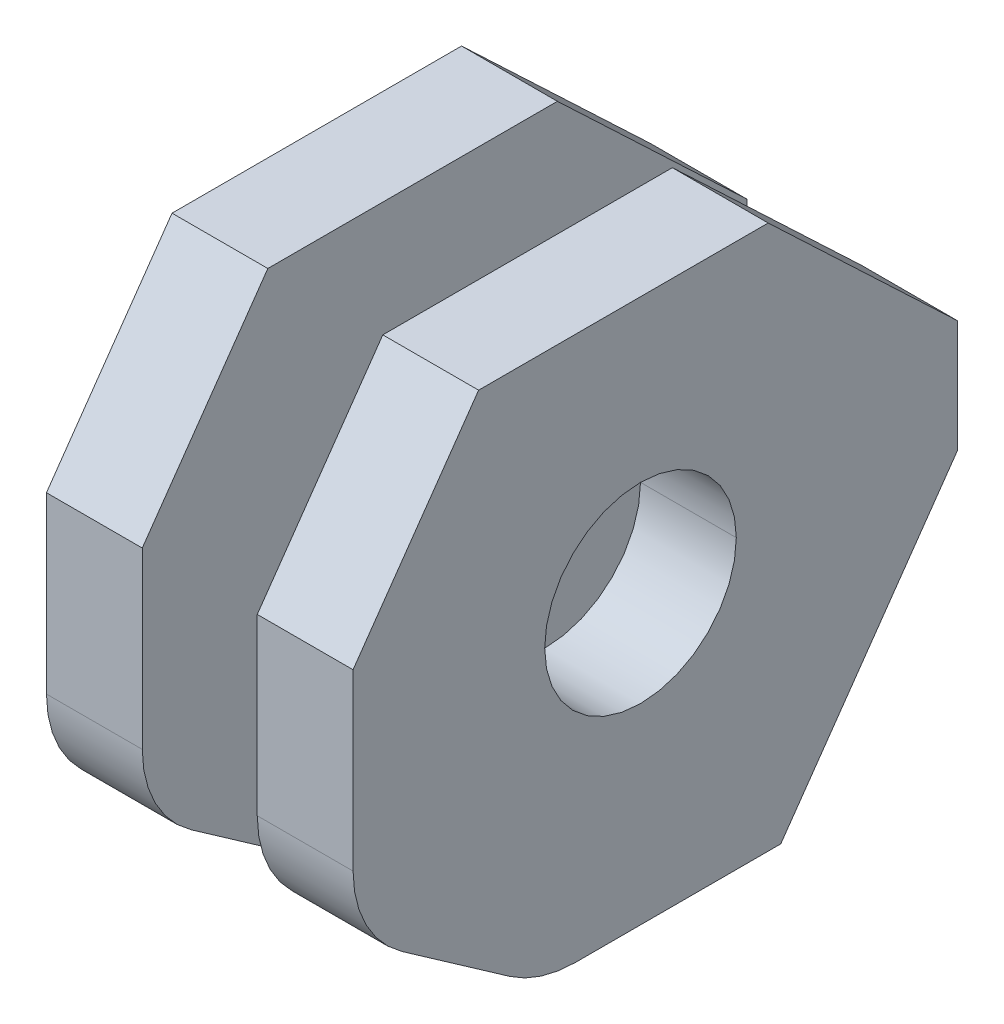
SolidWorks part; units mm, degrees
ref_plane "前视基准面" through (0, 0, 0) normal (0, 0, 1) x (1, 0, 0)
ref_plane "上视基准面" through (0, 0, 0) normal (0, 1, 0) x (1, 0, 0)
ref_plane "右视基准面" through (0, 0, 0) normal (1, 0, 0) x (0, 0, -1)
other "Configuration Table"
imported_body "D435_Mount_V3.STEP<1>"
sketch "草图2" plane through (4.3614, 0, 0) normal (1, 0, 0) x (0, 0, -1)
  line L0 (2.1509, 0) -> (-11.6217, -19.6693) construction
  line L1 (-11.6217, -25.8707) -> (-11.6217, 16.7514) construction
  line L2 (-11.6217, -20.4839) -> (-18.5046, -30.3138)
  line L3 (-18.5046, -30.3138) -> (-24.2387, -26.2987)
  line L4 (-24.2387, -26.2987) -> (-5.2675, 0.7949)
  line L6 (12.1509, -11.9874) -> (-6.545, -38.688)
  line L7 (-6.545, -38.688) -> (-0.8109, -42.703)
  line L8 (-0.8109, -42.703) -> (19.1509, -14.1945)
  line L9 (0.4665, -3.2201) -> (-5.2675, 0.7949)
  line L14 (12.1509, -11.9874) -> (12.1509, 5.1412)
  line L15 (12.1509, 5.1412) -> (19.1509, 5.1412)
  line L16 (19.1509, 5.1412) -> (19.1509, -14.1945)
  line L17 (2.1509, 0) -> (2.1509, -30) construction
  line L18 (0.4665, -3.2201) -> (-11.6217, -20.4839)
  circle A0 centre (-4.1217, -22.5) radius 2.5 construction
  dimension "D1" = 35
  dimension "D2" = 7.3
  dimension "D3" = 7
  dimension "D4" = 12
  dimension "D5" = 7.3
  dimension "D6" = 7
  dimension "D7" = 7
  dimension "D8" = 10
extrude "凸台-拉伸1" add sketch "草图2" against normal up to surface (8 mm away)
sketch "草图3" plane through (4.3614, 0, 0) normal (1, 0, 0) x (0, 0, -1)
  line L0 (-11.6217, -8.2798) -> (3.9788, 14)
  line L1 (39.8677, 14) -> (3.9788, 14)
  line L2 (39.8677, 14) -> (39.8677, 20.6985)
  line L3 (39.8677, 20.6985) -> (-17.6638, 20.6985)
  line L5 (2.1509, 0) -> (12.1509, 0) construction
  line L6 (-11.6217, -8.2798) -> (-24.2387, -26.2987) construction
  line L7 (-17.6638, 20.6985) -> (-11.6217, -8.2798)
  line L8 (-14.8253, -28.8946) -> (-7.3183, -34.151)
  line L9 (-7.3183, -34.151) -> (-5.1841, -31.1031)
  line L10 (-5.1841, -31.1031) -> (-12.6911, -25.8467)
  line L11 (-12.6911, -25.8467) -> (-14.8253, -28.8946)
  dimension "D1" = 14
extrude "切除-拉伸1" cut sketch "草图3" against normal through all
sketch "草图4" plane through (4.3614, 0, 0) normal (1, 0, 0) x (0, 0, -1)
  line L1 (-13.4768, -10.9291) -> (2.1509, -10.9291)
  line L2 (2.1509, 0) -> (2.1509, -26.2689) construction
  line L4 (9.8035, 0) -> (32.4075, 0)
  line L5 (2.1509, 0) -> (12.1509, 0) construction
  line L7 (50.1509, 4.5) -> (34.6753, 14) construction
  line L10 (32.4075, 0) -> (32.4075, 4.5)
  line L11 (30.1509, 4.5) -> (50.1509, 4.5) construction
  line L12 (32.4075, 4.5) -> (50.1509, 4.5)
  line L13 (50.1509, 4.5) -> (34.6753, 14)
  line L14 (3.9788, 14) -> (34.6753, 14)
  line L15 (3.9788, 14) -> (-13.4768, -10.9291)
  line L16 (3.9788, 14) -> (-24.2387, -26.2987) construction
  line L17 (2.1509, -10.9291) -> (9.8035, 0)
  line L18 (2.1509, 0) -> (12.1509, 0) construction
extrude "凸台-拉伸2" add sketch "草图4" against normal up to surface (8 mm away)
other "移动面1" parameters "D1"=1
other "移动面2" parameters "D1"=2
other "移动面6" parameters "D1"=2
fillet "圆角4" radius 20 2 edges at (0.3614, 14, -34.6753) (0.3614, 14, -3.9788)
fillet "圆角3" radius 3 7 edges at (0.3614, -26.2987, 24.2387) (0.3614, -42.703, 0.8109) (0.3614, 0, -7.362) (3.1114, -30, 6.7595) (-2.3886, -30, 6.7595) (-2.3886, -26.6468, 11.5484) (3.1114, -26.6468, 11.5484)
sketch "草图5" plane through (4.3614, 0, 0) normal (1, 0, 0) x (0, 0, -1)
  line L0 (-11.6217, -20.4839) -> (-8.3455, -15.8051)
  line L1 (-8.3455, -15.8051) -> (-0.7906, -15.8051)
  line L2 (-0.7906, -15.8051) -> (4.1509, -20.4839)
  line L3 (4.1509, -4.5859) -> (4.1509, -23.4126) construction
  line L4 (4.1509, -20.4839) -> (4.1509, -23.4126)
  line L5 (4.1509, -23.4126) -> (-0.4616, -30)
split "分割1" trim tools "草图5" bodies to split 115 resulting bodies 116 117 118
delete or keep bodies "实体-删除/保留 1" type delete bodies bodies 118
